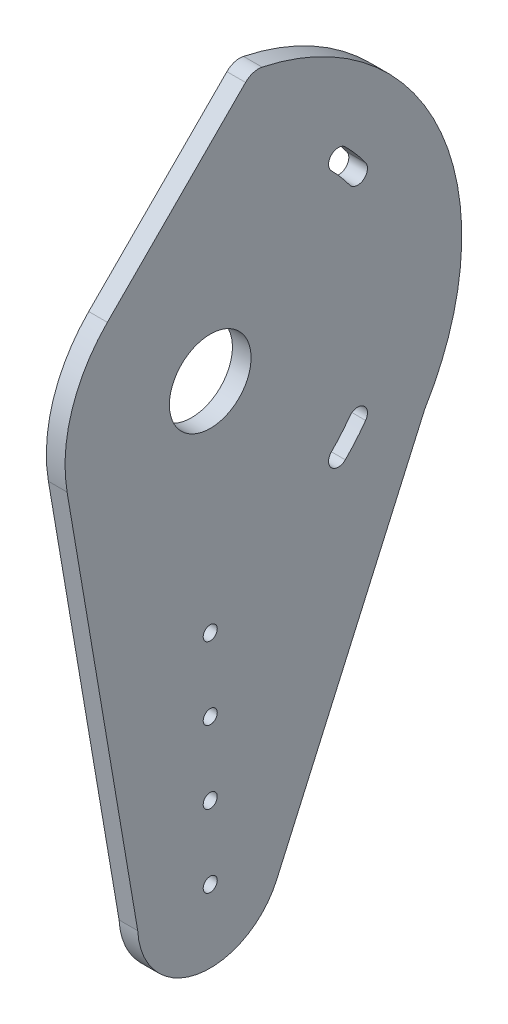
SolidWorks part; units mm, degrees
ref_plane "Front Plane" through (0, 0, 0) normal (0, 0, 1) x (1, 0, 0)
ref_plane "Top Plane" through (0, 0, 0) normal (0, 1, 0) x (1, 0, 0)
ref_plane "Right Plane" through (0, 0, 0) normal (1, 0, 0) x (0, 0, -1)
sketch "Sketch1" plane through (0, 0, 0) normal (1, 0, 0) x (0, 0, -1)
  line L0 (-35.9833, 35.8586) -> (14.7284, 86.7467)
  line L1 (0, 0) -> (152.4, 0) construction
  line L2 (0, 0) -> (107.5758, -107.95) construction
  line L3 (0, 0) -> (107.5758, 107.95) construction
  line L4 (0, 0) -> (123.7843, 88.9) construction
  line L5 (-50.0801, -8.5218) -> (-38.1713, -78.5065)
  line L6 (0, 0) -> (0, -152.4) construction
  line L8 (-38.1713, -78.5065) -> (-25.3625, -153.7803)
  line L9 (0, 0) -> (123.7843, -88.9) construction
  line L10 (23.2158, -162.7047) -> (75.0455, -45.9358)
  circle A0 centre (0, 0) radius 63.5 construction
  circle A1 centre (0, 0) radius 14.2875
  arc A3 (44.8233, 44.9792) -> (51.5768, 37.0417) centre (0, 0) cw construction
  arc A4 (54.3619, 39.0419) -> (47.2437, 47.408) centre (0, 0) ccw
  arc A5 (48.7916, 35.0414) -> (42.4028, 42.5503) centre (0, 0) ccw
  arc A6 (48.7916, 35.0414) -> (54.3619, 39.0419) centre (51.5768, 37.0417) ccw
  arc A7 (47.2437, 47.408) -> (42.4028, 42.5503) centre (44.8233, 44.9792) ccw
  arc A8 (44.8233, -44.9792) -> (51.5768, -37.0417) centre (0, 0) ccw construction
  arc A13 (54.3619, -39.0419) -> (47.2437, -47.408) centre (0, 0) cw
  arc A14 (48.7916, -35.0414) -> (42.4028, -42.5503) centre (0, 0) cw
  arc A15 (48.7916, -35.0414) -> (54.3619, -39.0419) centre (51.5768, -37.0417) cw
  arc A16 (47.2437, -47.408) -> (42.4028, -42.5503) centre (44.8233, -44.9792) cw
  arc A17 (-35.9833, 35.8586) -> (-50.0801, -8.5218) centre (0, 0) ccw
  arc A19 (-25.3625, -153.7803) -> (23.2158, -162.7047) centre (0, -152.4) ccw
  arc A20 (75.0455, -45.9358) -> (14.7284, 86.7467) centre (0, 0) ccw
  point P7 (48.3631, 41.1492)
  point P14 (48.3631, -41.1492)
  point P25 (0, -50.8)
  dimension "D1" = 28.575
  dimension "D2" = 127
  dimension "D3" = 25.4
  dimension "D7" = 6.858
  dimension "D8" = 101.6
  dimension "D4" = 152.4
  dimension "D5" = 215.9
  dimension "D6" = 177.8
  dimension "D10" = 152.4
extrude "Boss-Extrude1" add sketch "Sketch1" along normal blind 6.5278
hole_wizard "#10 (0.1935) Diameter Hole1" positions "Sketch2" profile "Sketch3" hole size "#10" standard "ANSI Inch"
sketch "Sketch2" plane through (6.5278, 0, 0) normal (1, 0, 0) x (0, 0, -1)
  arc A0 (-25.3625, -153.7803) -> (23.2158, -162.7047) centre (0, -152.4) ccw construction
  point P0 (0, -152.4)
  point P19 (0, -127)
  point P20 (0, -101.6)
  point P21 (0, -76.2)
  dimension "D1" = 4
sketch "Sketch3" plane through (6.5278, -152.4, 0) normal (0, 1, 0) x (0, 0, -1)
  line L0 (0, 0) -> (0, 6.5278)
  line L1 (0, 6.5278) -> (2.4574, 6.5278)
  line L2 (2.4574, 6.5278) -> (2.4574, 0)
  line L5 (2.4574, 0) -> (0, 0)
  line L11 (0, -6.35) -> (0, 107.95) construction
  dimension "Thru Hole Dia." = 4.9149
  dimension "Thru Hole Depth" = 6.5278
fillet "Fillet1" radius 6.35 1 edges at (3.2639, 86.7467, -14.7284)
